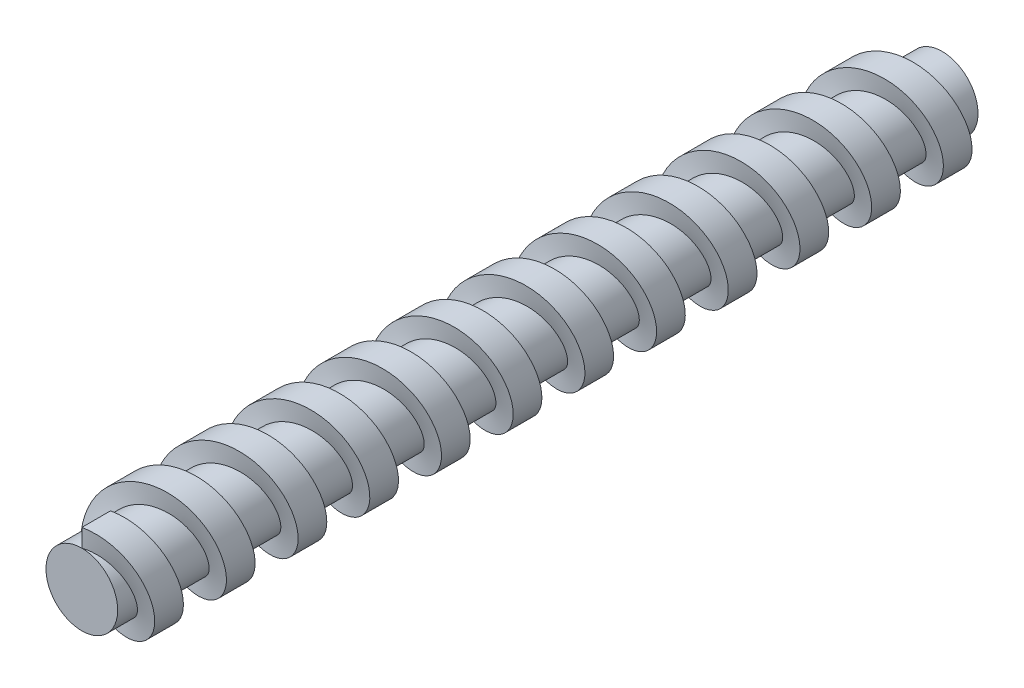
SolidWorks part; units mm, degrees
ref_plane "Face" through (0, 0, 0) normal (0, 0, 1) x (1, 0, 0)
ref_plane "Dessus" through (0, 0, 0) normal (0, 1, 0) x (1, 0, 0)
ref_plane "Droite" through (0, 0, 0) normal (1, 0, 0) x (0, 0, -1)
sketch "Esquisse1" plane through (0, 0, 0) normal (0, 0, 1) x (1, 0, 0)
  circle A0 centre (0, 0) radius 2.5
  dimension "D1" = 5
extrude "Extrusion1" add sketch "Esquisse1" along normal blind 60
sketch "Esquisse2" plane through (0, 0, 0) normal (1, 0, 0) x (0, 0, -1)
  line L0 (0, 2.5) -> (-60, 2.5) construction
  line L1 (-58, 3.75) -> (-60, 3.75)
  line L2 (-58, 3.75) -> (-58, 1.25)
  line L3 (-58, 1.25) -> (-60, 1.25)
  line L4 (-60, 3.75) -> (-60, 1.25)
  line L5 (-58, 3.75) -> (-60, 1.25) construction
  line L6 (-58, 1.25) -> (-60, 3.75) construction
  line L7 (-60, 2.5) -> (-60, -2.5) construction
  point P0 (-59, 2.5)
  dimension "D1" = 2
  dimension "D2" = 2.5
sketch "Esquisse3" plane through (0, 0, 60) normal (0, 0, 1) x (1, 0, 0)
  circle A0 centre (0, 0) radius 2.5
curve "Hélice/Spirale1"
sweep "Balayage1" add profiles "Esquisse2" path "Hélice/Spirale1"
